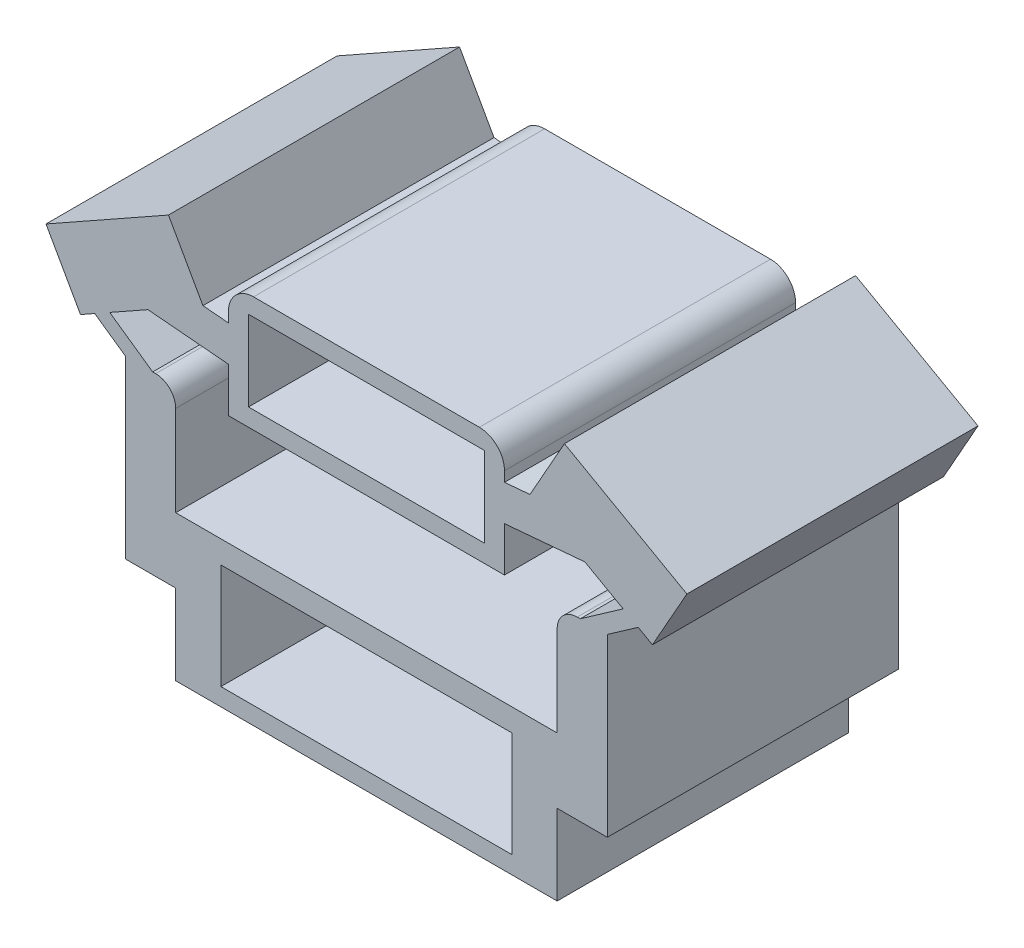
SolidWorks part; units mm, degrees
ref_plane "前视基准面" through (0, 0, 0) normal (0, 0, 1) x (1, 0, 0)
ref_plane "上视基准面" through (0, 0, 0) normal (0, 1, 0) x (1, 0, 0)
ref_plane "右视基准面" through (0, 0, 0) normal (1, 0, 0) x (0, 0, -1)
other "Configuration Table"
sketch "草图1" plane through (0, 0, 0) normal (0, 0, 1) x (1, 0, 0)
  line L0 (2.75, 5.2) -> (3.2581, 5.2444)
  line L1 (-3.8, -1.4) -> (3.8, -1.4)
  line L2 (-3.8, -1.4) -> (-3.8, 1.4)
  line L4 (3.8, -1.4) -> (3.8, 0.1)
  line L5 (-3.8, -1.4) -> (3.8, 1.4) construction
  line L6 (-3.8, 1.4) -> (3.8, -1.4) construction
  line L7 (-2.75, 5.2) -> (2.75, 5.2)
  line L8 (-2.75, 5.2) -> (-2.75, 3.6)
  line L9 (-2.75, 3.6) -> (2.75, 3.6)
  line L10 (2.75, 4.4873) -> (2.75, 3.6)
  line L11 (-2.75, 5.2) -> (2.75, 3.6) construction
  line L12 (-2.75, 3.6) -> (2.75, 5.2) construction
  line L14 (3.8, 0.1) -> (4.8, 0.1)
  line L17 (3.945, 6.4643) -> (3.2581, 5.2444)
  line L19 (3.945, 6.4643) -> (6.3848, 5.0904)
  line L33 (2.75, 5.2) -> (2.75, 4.4873) construction
  line L34 (3.2581, 5.2444) -> (4.3535, 4.6276) construction
  line L37 (4.8, 3.6) -> (4.8, 0.1)
  line L38 (-3.8, 1.4) -> (3.8, 1.4)
  line L39 (3.8, 1.4) -> (3.8, 0.1) construction
  line L40 (0, 9.062) -> (0, -4.0269) construction
  line L41 (2.75, 4.4873) -> (4.3535, 4.6276)
  line L48 (4.3535, 4.6276) -> (5.1148, 4.1989)
  line L51 (4.2595, 3.6) -> (5.1148, 4.1989)
  line L53 (5.4144, 4.0302) -> (5.6978, 3.8706)
  line L55 (5.1148, 4.1989) -> (5.4144, 4.0302) construction
  line L56 (4.2595, 3.6) -> (4.8, 3.6) construction
  line L57 (3.8, 1.4) -> (3.8, 3.6)
  line L58 (3.8, 3.6) -> (4.2595, 3.6)
  line L59 (4.8, 3.6) -> (5.4144, 4.0302)
  line L60 (5.6978, 3.8706) -> (6.3848, 5.0904)
  point P0 (0, 0)
  point P6 (0, 4.4)
  dimension "D1" = 7.6
  dimension "D2" = 2.8
  dimension "D3" = 5.5
  dimension "D4" = 1.6
  dimension "D5" = 1
  dimension "D6" = 35
  dimension "D7" = 0.51
  dimension "D8" = 0.71
  dimension "D9" = 3.5
  dimension "D10" = 1.4
  dimension "D11" = 0.31
  dimension "D12" = 2.2
  dimension "D13" = 0.75
  dimension "D14" = 2.2
  dimension "D15" = 2.8
  dimension "D16" = 95
extrude "凸台-拉伸1" add sketch "草图1" along normal blind 5.8
mirror "镜向1" about plane through (0, 0, 0) normal (1, 0, 0) of "凸台-拉伸1"
sketch "草图10" plane through (0, 0, 5.8) normal (0, 0, 1) x (1, 0, 0)
  line L0 (-2.75, 3.6) -> (2.75, 3.6) construction
  line L1 (-2.9, -1.05) -> (2.9, -1.05)
  line L2 (-2.9, -1.05) -> (-2.9, 1.05)
  line L3 (-2.9, 1.05) -> (2.9, 1.05)
  line L4 (2.9, -1.05) -> (2.9, 1.05)
  line L5 (-2.9, -1.05) -> (2.9, 1.05) construction
  line L6 (-2.9, 1.05) -> (2.9, -1.05) construction
  line L7 (-2.35, 5.55) -> (2.35, 5.55)
  line L8 (-2.35, 5.55) -> (-2.35, 3.95)
  line L9 (-2.35, 3.95) -> (2.35, 3.95)
  line L10 (2.35, 5.55) -> (2.35, 3.95)
  point P0 (0, 0)
  point P10 (0, 5.55)
  dimension "D1" = 5.8
  dimension "D2" = 2.1
  dimension "D3" = 4.7
  dimension "D4" = 1.6
  dimension "D5" = 0.35
extrude "切除-拉伸3" cut sketch "草图10" against normal through all
sketch "草图11" plane through (0, 0, 5.8) normal (0, 0, 1) x (1, 0, 0)
  line L0 (-2.35, 5.2) -> (-2.75, 5.2)
  line L1 (-2.75, 5.2) -> (-2.75, 5.9)
  line L2 (-2.75, 5.9) -> (2.75, 5.9)
  line L3 (2.75, 5.9) -> (2.75, 5.2)
  line L4 (2.75, 3.6) -> (2.75, 4.4873) construction
  line L5 (2.75, 5.2) -> (2.35, 5.2)
  line L6 (2.35, 5.2) -> (2.35, 5.55)
  line L7 (2.35, 5.55) -> (-2.35, 5.55)
  line L8 (-2.35, 5.55) -> (-2.35, 5.2)
  line L9 (-2.35, 3.95) -> (2.35, 3.95) construction
  dimension "D1" = 0.35
  dimension "D2" = 1.6
extrude "凸台-拉伸2" add sketch "草图11" against normal up to surface (5.8 mm away)
fillet "圆角1" radius 0.5 2 edges at (-2.75, 5.9, 2.9) (2.75, 5.9, 2.9)
sketch "草图12" plane through (0, 0, 5.8) normal (0, 0, 1) x (1, 0, 0)
  line L0 (-2.9, 1.05) -> (-2.9, -1.05) construction
  line L1 (-2.9, 0.95) -> (2.9, 0.95)
  line L2 (-2.9, 0.95) -> (-2.9, 1.05)
  line L3 (-2.9, 1.05) -> (2.9, 1.05)
  line L4 (2.9, 0.95) -> (2.9, 1.05)
  line L5 (3.8, -1.4) -> (3.8, 0.1) construction
  line L6 (-3.8, -1.4) -> (3.8, -1.4)
  line L7 (-3.8, -1.4) -> (-3.8, -1.5)
  line L8 (-3.8, -1.5) -> (3.8, -1.5)
  line L9 (3.8, -1.4) -> (3.8, -1.5)
  dimension "D1" = 0.1
  dimension "D2" = 0.1
extrude "凸台-拉伸3" add sketch "草图12" against normal up to surface (5.8 mm away)
sketch "草图14" plane through (0, 0, 5.8) normal (0, 0, 1) x (1, 0, 0)
  line L0 (2.9, -1.05) -> (2.9, 0.95) construction
  line L1 (-2.9, -1.05) -> (2.9, -1.05)
  line L2 (-2.9, -1.05) -> (-2.9, -1.15)
  line L3 (-2.9, -1.15) -> (2.9, -1.15)
  line L4 (2.9, -1.05) -> (2.9, -1.15)
  dimension "D1" = 0.1
extrude "切除-拉伸4" cut sketch "草图14" against normal through all
sketch "草图15" plane through (0, 0, 5.8) normal (0, 0, 1) x (1, 0, 0)
  line L0 (0, 5.2) -> (0, 1.4)
  line L2 (3.8, 1.4) -> (-3.8, 1.4) construction
  line L3 (0, 1.4) -> (3.8, 1.4)
  line L4 (3.8, 1.4) -> (3.8, 3.6)
  line L5 (3.8, 3.6) -> (4.8, 3.6)
  line L6 (4.8, 3.6) -> (5.4144, 4.0302)
  line L7 (5.4144, 4.0302) -> (3.2581, 5.2444)
  line L8 (3.2581, 5.2444) -> (2.75, 5.2)
  line L9 (2.75, 5.2) -> (0, 5.2)
sketch "草图16" plane through (0, 0, 5.8) normal (0, 0, 1) x (1, 0, 0)
  line L0 (-2.35, 5.55) -> (-2.35, 3.95) construction
  line L1 (-2.35, 4.05) -> (2.35, 4.05)
  line L2 (-2.35, 4.05) -> (-2.35, 3.95)
  line L3 (-2.35, 3.95) -> (2.35, 3.95)
  line L4 (2.35, 4.05) -> (2.35, 3.95)
  dimension "D1" = 0.1
extrude "凸台-拉伸4" [suppressed] add sketch "草图16" against normal up to surface (5.8 mm away)
fillet "圆角2" radius 0.4 2 edges at (-3.8, 3.6, 2.9) (3.8, 3.6, 2.9)
sketch "草图17" plane through (0, 0, 5.8) normal (0, 0, 1) x (1, 0, 0)
  line L0 (-2.9, 2.0221) -> (-2.9, -1.8376)
  line L1 (-2.35, 6.4076) -> (-2.35, 2.8612)
